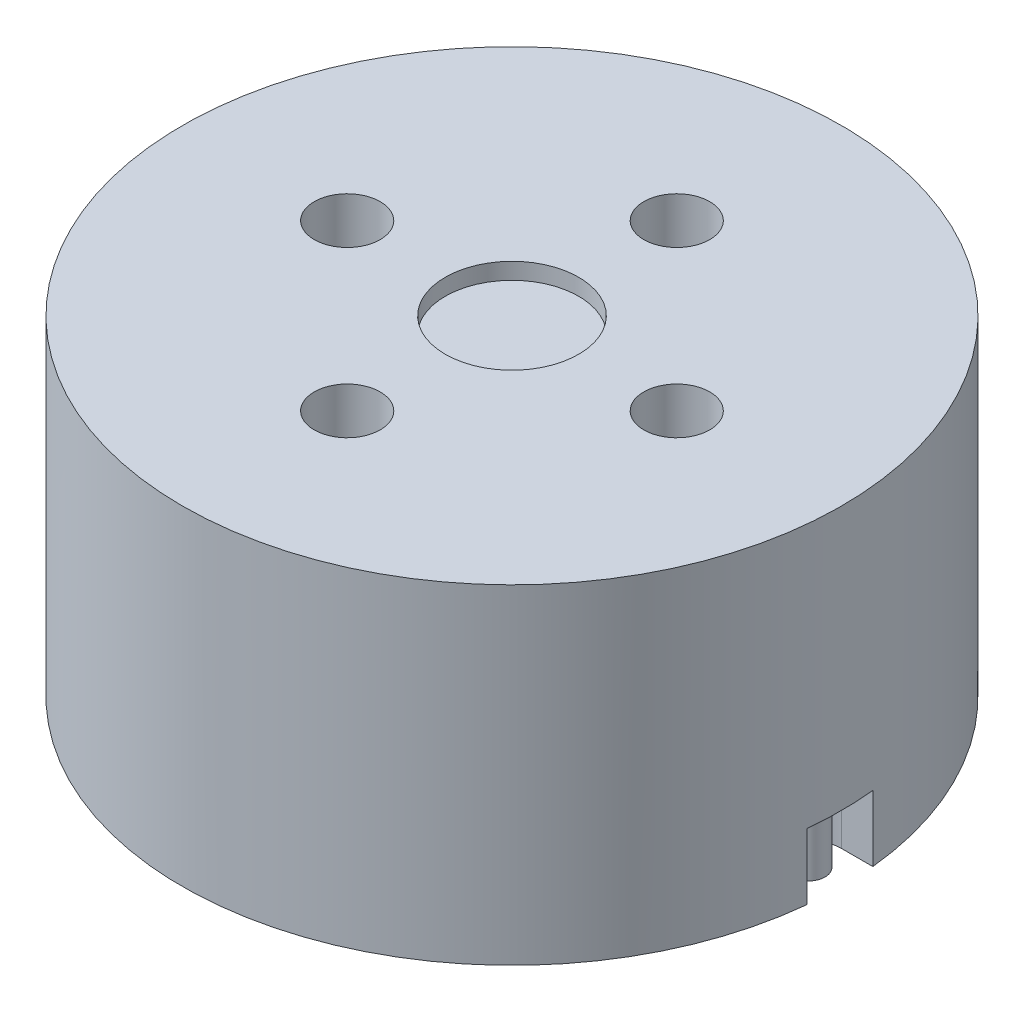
SolidWorks part; units mm, degrees
ref_plane "Front Plane" through (0, 0, 0) normal (0, 0, 1) x (1, 0, 0)
ref_plane "Top Plane" through (0, 0, 0) normal (0, 1, 0) x (1, 0, 0)
ref_plane "Right Plane" through (0, 0, 0) normal (1, 0, 0) x (0, 0, -1)
sketch "Sketch1" plane through (0, 0, 0) normal (0, 1, 0) x (1, 0, 0)
  circle A0 centre (0, 0) radius 20
  dimension "D1" = 40
extrude "Boss-Extrude1" add sketch "Sketch1" along normal blind 20
sketch "Sketch2" plane through (0, 20, 0) normal (0, 1, 0) x (1, 0, 0)
  line L0 (0, 0) -> (0, 10) construction
  line L1 (-10, 0) -> (0, 0) construction
  circle A0 centre (0, 0) radius 10 construction
  circle A1 centre (0, 10) radius 2
  circle A2 centre (10, 0) radius 2
  circle A3 centre (0, -10) radius 2
  circle A4 centre (-10, 0) radius 2
  point P14 (0, 0)
  dimension "D1" = 20
  dimension "D2" = 4
  dimension "D4" = 90
  dimension "D3" = 4
extrude "Cut-Extrude1" cut sketch "Sketch2" against normal through all
sketch "Sketch3" plane through (0, 20, 0) normal (0, 1, 0) x (1, 0, 0)
  circle A0 centre (0, 0) radius 4.05
  dimension "D1" = 8.1
extrude "Cut-Extrude2" cut sketch "Sketch3" against normal blind 1
sketch "Sketch4" plane through (0, 0, 0) normal (0, -1, 0) x (1, 0, 0)
  circle A0 centre (0, 0) radius 1
  dimension "D1" = 2
extrude "Cut-Extrude3" cut sketch "Sketch4" against normal blind 4
sketch "Sketch5" plane through (0, 0, 0) normal (0, -1, 0) x (-1, 0, 0)
  line L0 (18, -2) -> (19.8997, -2)
  line L1 (18, 2) -> (19.8997, 2)
  line L2 (18, 0) -> (0, 0) construction
  line L3 (0, 0) -> (0, 8) construction
  line L4 (-18, 2) -> (-19.8997, 2)
  line L5 (-18, -2) -> (-19.8997, -2)
  circle A3 centre (0, 10) radius 2 construction
  circle A4 centre (18, 0) radius 1
  arc A5 (18, 2) -> (18, -2) centre (18, 0) ccw
  circle A6 centre (10, 0) radius 2 construction
  circle A7 centre (0, 0) radius 20 construction
  arc A8 (19.8997, -2) -> (19.8997, 2) centre (0, 0) ccw
  circle A9 centre (0, 0) radius 1 construction
  circle A10 centre (-18, 0) radius 1
  arc A11 (-19.8997, -2) -> (-19.8997, 2) centre (0, 0) cw
  arc A12 (-18, 2) -> (-18, -2) centre (-18, 0) cw
extrude "Cut-Extrude4" cut sketch "Sketch5" against normal blind 4
sketch "Sketch6" plane through (0, 4, 0) normal (0, -1, 0) x (-1, 0, 0)
  circle A0 centre (0, 0) radius 1
  dimension "D1" = 2
extrude "Boss-Extrude2" add sketch "Sketch6" along normal blind 15
